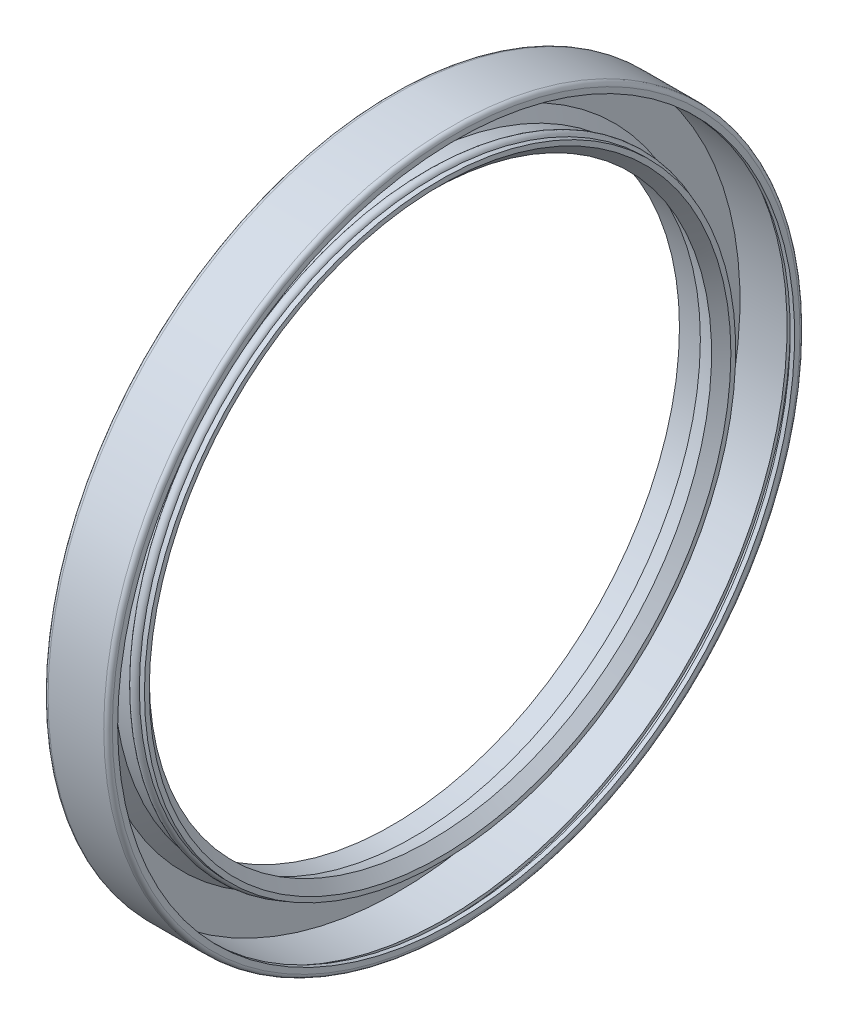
SolidWorks part; units mm, degrees
ref_plane "Plan1" through (0, 0, 0) normal (0, 0, 1) x (1, 0, 0)
ref_plane "Plan2" through (0, 0, 0) normal (0, 1, 0) x (1, 0, 0)
ref_plane "Plan3" through (0, 0, 0) normal (1, 0, 0) x (0, 0, -1)
sketch "Esquisse1" plane through (0, 0, 0) normal (0, 1, 0) x (1, 0, 0)
  line L0 (0, 0) -> (10, 0) construction
  line L1 (0, 53.7) -> (0, 64.2)
  line L2 (0.8, 65) -> (11.2, 65)
  line L3 (10, 63.8) -> (10, 64.4)
  line L4 (10, 63.8) -> (1.2, 63.8)
  line L5 (1.2, 63.8) -> (1.2, 57.0452)
  line L6 (3.903, 53.7) -> (0, 53.7)
  line L9 (10, 64.4) -> (11.2, 64.4)
  line L11 (11.2, 64.4) -> (11.2, 63.2)
  line L12 (12, 63.2) -> (12, 64.2)
  line L13 (11.2, 63.2) -> (12, 63.2)
  line L14 (3.903, 53.7) -> (7.2, 52.5)
  line L15 (7.2, 52.5) -> (9, 54.3)
  line L16 (9, 54.3) -> (9, 55.2)
  line L17 (9, 55.2) -> (8.0485, 55.2)
  line L18 (1.2, 57.0452) -> (3, 54.9)
  line L22 (3, 54.9) -> (6.3, 54.9)
  arc A0 (0, 64.2) -> (0.8, 65) centre (0.8, 64.2) cw
  arc A1 (8.0485, 55.2) -> (6.3, 54.9) centre (7.2, 54.9) ccw
  arc A2 (11.2, 65) -> (12, 64.2) centre (11.2, 64.2) cw
  point P13 (0, 65)
  point P22 (12, 65)
  dimension "r" = 0.8
  dimension "l" = 1.8
  dimension "D1" = 130
  dimension "De" = 65
  dimension "b" = 12
  dimension "e" = 1.2
  dimension "D7" = 45
  dimension "D6" = 20
  dimension "Di" = 52.5
  dimension "pl" = 9
  dimension "h" = 0.3
revolve "Base-Révolution" add sketch "Esquisse1" angle 360 about L0
sketch "Esquisse2" plane through (0, 0, 0) normal (-1, 0, 0) x (0, 0, 1)
  line L0 (0, 0) -> (53.7, 0) construction
  line L1 (53.7, 0) -> (54.3, 0) construction
  circle A0 centre (0, 0) radius 53.7 construction
  circle A2 centre (0, 0) radius 53.7 construction
  circle A3 centre (0, 0) radius 54.3
equation "\"e@Esquisse1\" = \"b@Esquisse1\"/10"
equation "\"i@Esquisse1\"=\"e@Esquisse1\"/2"
equation "\"r@Esquisse1\"=\"e@Esquisse1\"*2/3"
equation "\"l@Esquisse1\"=\"i@Esquisse1\"*3"
equation "\"pl@Esquisse1\"=\"b@Esquisse1\"*3/4"
equation "\"h@Esquisse1\"=\"i@Esquisse1\"/2"
